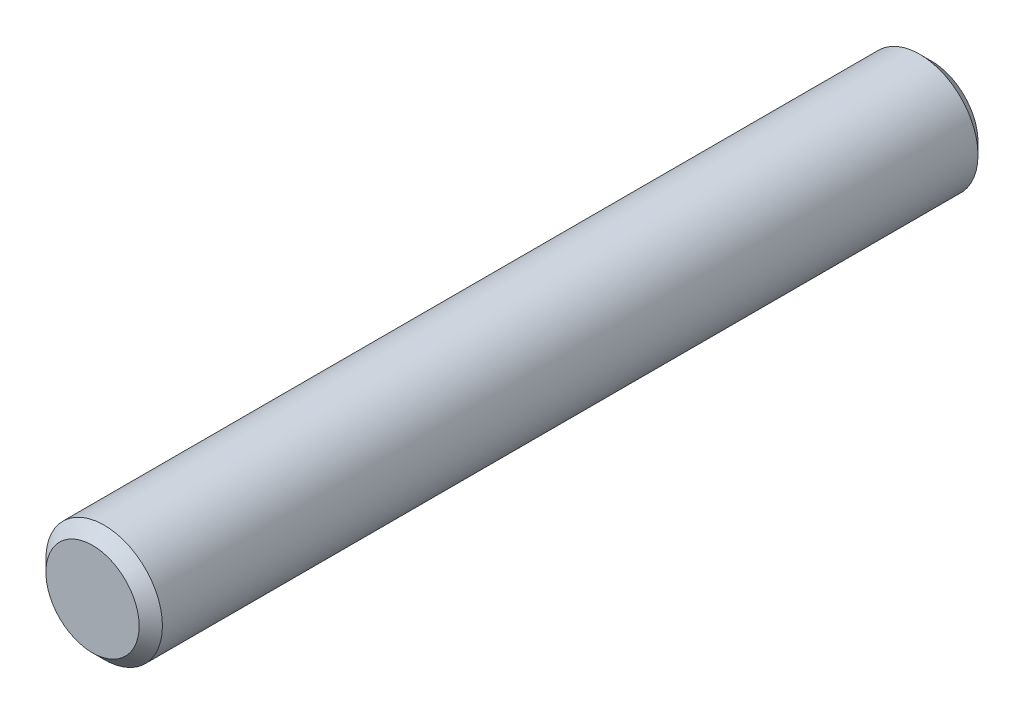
SolidWorks part; units mm, degrees
ref_plane "Front" through (0, 0, 0) normal (0, 0, 1) x (1, 0, 0)
ref_plane "Top" through (0, 0, 0) normal (0, 1, 0) x (1, 0, 0)
ref_plane "Right" through (0, 0, 0) normal (1, 0, 0) x (0, 0, -1)
sketch "Эскиз1" plane through (0, 0, 0) normal (0, 0, 1) x (1, 0, 0)
  circle A0 centre (-11.8089, 14.629) radius 5
extrude "Вытянуть1" add sketch "Эскиз1" along normal blind 72
chamfer "Фаска1" distance 1 angle 45 2 edges at (-6.8089, 14.629, 0) (-6.8089, 14.629, 72)
